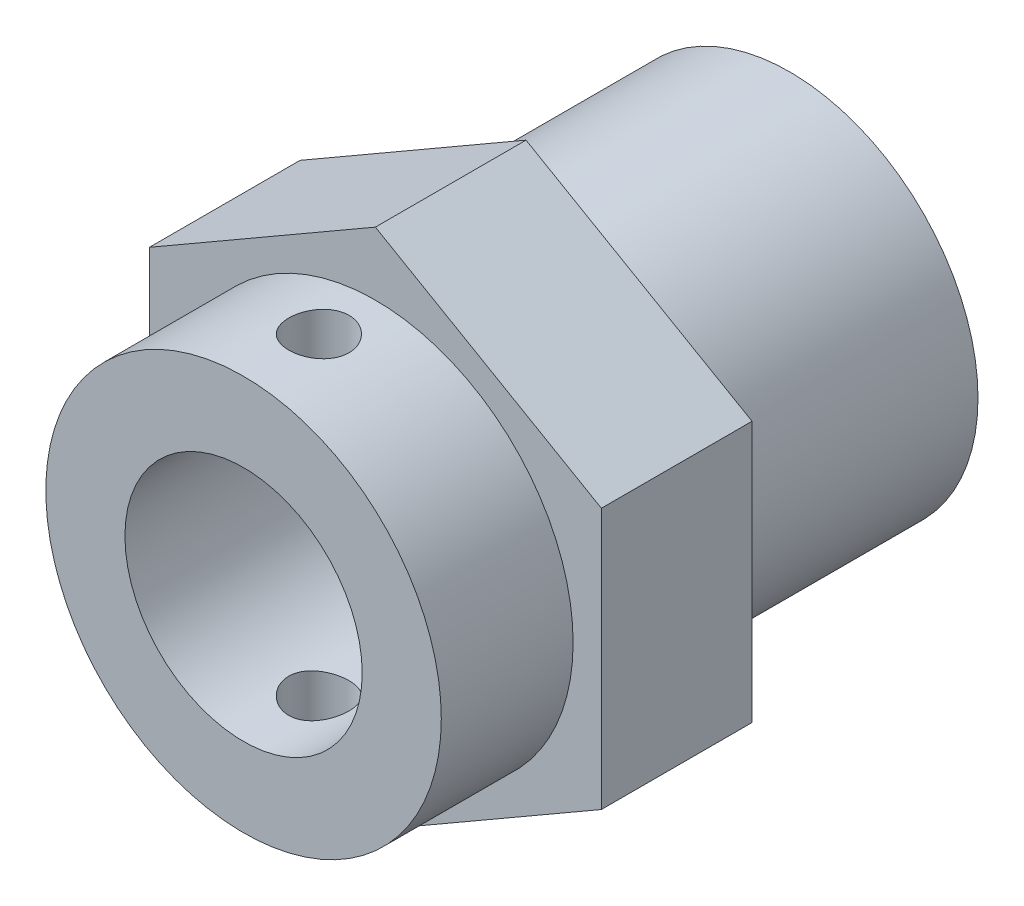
SolidWorks part; units mm, degrees
ref_plane "Ebene vorne" through (0, 0, 0) normal (0, 0, 1) x (1, 0, 0)
ref_plane "Ebene oben" through (0, 0, 0) normal (0, 1, 0) x (1, 0, 0)
ref_plane "Ebene rechts" through (0, 0, 0) normal (1, 0, 0) x (0, 0, -1)
sketch "Skizze1" plane through (0, 0, 0) normal (0, 0, 1) x (1, 0, 0)
  circle A0 centre (0, 0) radius 5
  dimension "D1" = 10
extrude "Aufsatz-Linear austragen1" add sketch "Skizze1" against normal blind 7
sketch "Skizze2" plane through (0, 0, 0) normal (0, 0, 1) x (1, 0, 0)
  line L0 (0, 0) -> (0, 7.2368) construction
  line L1 (6, 3.4641) -> (0, 6.9282)
  line L2 (0, 6.9282) -> (-6, 3.4641)
  line L3 (-6, 3.4641) -> (-6, -3.4641)
  line L4 (-6, -3.4641) -> (0, -6.9282)
  line L5 (0, -6.9282) -> (6, -3.4641)
  line L6 (6, -3.4641) -> (6, 3.4641)
  line L7 (0, 0) -> (0, -8.9091) construction
  circle A0 centre (0, 0) radius 6 construction
  dimension "D1" = 12
extrude "Aufsatz-Linear austragen2" add sketch "Skizze2" along normal blind 4
sketch "Skizze3" plane through (0, 0, 4) normal (0, 0, 1) x (1, 0, 0)
  circle A0 centre (0, 0) radius 5.25
  dimension "D1" = 10.5
extrude "Aufsatz-Linear austragen3" add sketch "Skizze3" along normal blind 3.5
sketch "Skizze4" plane through (0, 0, 7.5) normal (0, 0, 1) x (1, 0, 0)
  circle A0 centre (0, 0) radius 3.15
  dimension "D1" = 6.3
extrude "Schnitt-Linear austragen1" cut sketch "Skizze4" against normal through all
sketch "Skizze5" plane through (0, 0, -7) normal (0, 0, -1) x (-1, 0, 0)
  circle A0 centre (0, 0) radius 3.15
  dimension "D1" = 6.3
sketch "Skizze6" plane through (0, 0, -7) normal (0, 0, -1) x (-1, 0, 0)
  circle A0 centre (0, 0) radius 3.15
  dimension "D1" = 6.3
extrude "Aufsatz-Linear austragen5" add sketch "Skizze6" against normal blind 10 separate body
ref_plane "Ebene1" through (0, 5.25, 0) normal (0, 1, 0) x (1, 0, 0)
sketch "Skizze8" plane through (0, 5.25, 0) normal (0, 1, 0) x (1, 0, 0)
  line L0 (0, 7.7132) -> (0, -11.4515) construction
  line L1 (-5.25, -7.5) -> (5.25, -7.5) construction
  circle A0 centre (0, -5.5) radius 0.8
  dimension "D1" = 1.6
  dimension "D2" = 2
extrude "Schnitt-Linear austragen2" cut sketch "Skizze8" against normal through all
